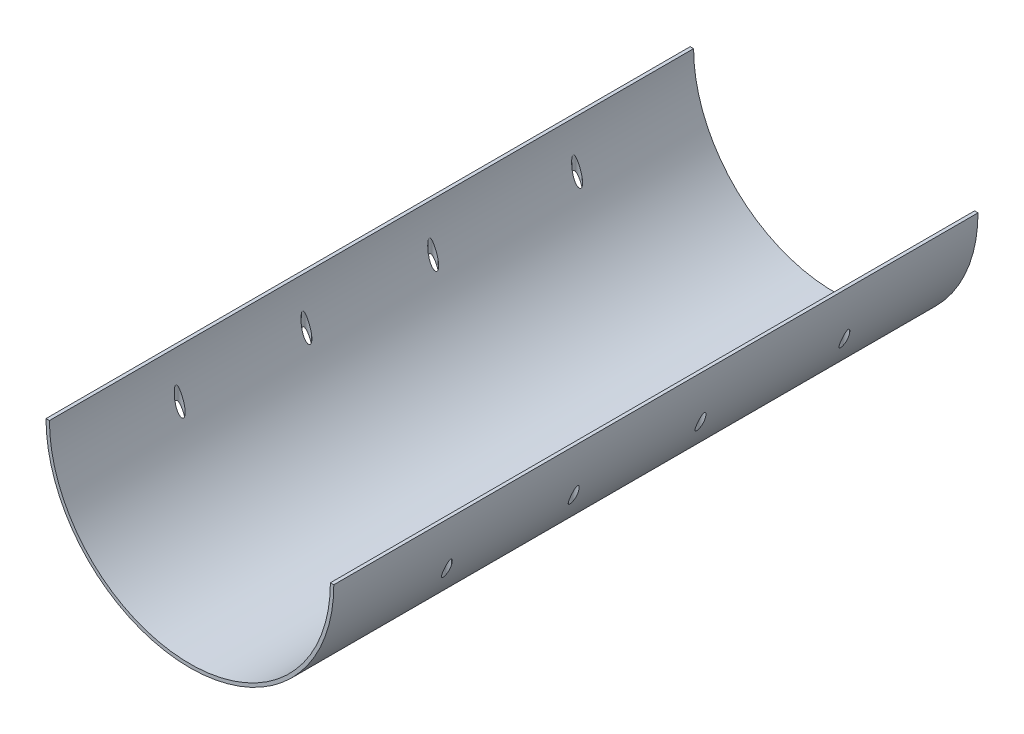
SolidWorks part; units mm, degrees
ref_plane "Plane1" through (0, 0, 0) normal (0, 0, 1) x (1, 0, 0)
ref_plane "Plane2" through (0, 0, 0) normal (0, 1, 0) x (1, 0, 0)
ref_plane "Plane3" through (0, 0, 0) normal (1, 0, 0) x (0, 0, -1)
sketch "Sketch1" plane through (0, 0, 0) normal (0, 0, 1) x (1, 0, 0)
  line L0 (-266.7, 0) -> (-260.35, 0)
  line L1 (260.35, 0) -> (266.7, 0)
  arc A0 (-260.35, 0) -> (260.35, 0) centre (0, 0) ccw
  arc A1 (-266.7, 0) -> (266.7, 0) centre (0, 0) ccw
  dimension "D1" = 520.7
  dimension "D2" = 533.4
extrude "Base-Extrude" add sketch "Sketch1" along normal blind 1193.8
sketch "Sketch2" plane through (0, 0, 0) normal (0, 1, 0) x (1, 0, 0)
  line L0 (0, 0) -> (0, -1016) construction
  line L1 (0, -1193.8) -> (0, 0) construction
  line L2 (-260.35, -1193.8) -> (260.35, -1193.8) construction
  line L3 (0, -1016) -> (0, -1868.9552) construction
  circle A0 centre (0, -279.4) radius 12.7
  circle A1 centre (0, -965.2) radius 12.7
  circle A2 centre (0, -508) radius 12.7
  circle A3 centre (0, -736.6) radius 12.7
  dimension "D1" = 25.4
  dimension "D3" = 228.6
  dimension "D9" = 228.6
  dimension "D4" = 228.6
  dimension "D2" = 279.4
  dimension "D6" = 228.6
extrude "DrainHoles" [suppressed] cut sketch "Sketch2" against normal through all
sketch "Sketch3" plane through (0, 0, 0) normal (0, 1, 0) x (-1, 0, 0)
  line L0 (4.9403, 774.4798) -> (4.9403, 760.045)
  line L1 (1.7653, 756.87) -> (-1.4097, 756.87)
  line L2 (-4.5847, 760.045) -> (-4.5847, 774.4798)
  line L3 (0.1778, 840.105) -> (0.1778, 741.1428) construction
  arc A1 (7.7341, 777.6318) -> (-7.3785, 777.6318) centre (0.1778, 840.105) ccw
  arc A2 (3.9878, 779.8368) -> (-3.6322, 779.8368) centre (0.1778, 840.105) ccw construction
  arc A3 (1.7653, 756.87) -> (4.9403, 760.045) centre (1.7653, 760.045) ccw
  arc A4 (-1.4097, 756.87) -> (-4.5847, 760.045) centre (-1.4097, 760.045) cw
  arc A5 (4.9403, 774.4798) -> (7.7341, 777.6318) centre (8.1153, 774.4798) cw
  arc A6 (-7.3785, 777.6318) -> (-4.5847, 774.4798) centre (-7.7597, 774.4798) cw
  dimension "D1" = 2.54
  dimension "D3" = 3.175
  dimension "D4" = 3.175
  dimension "D2" = 9.525
extrude "Cut-Extrude1" [suppressed] cut sketch "Sketch3" against normal through all
sketch "Sketch4" [suppressed] plane through (0, 0, 555.625) normal (0, 0, 1) x (1, 0, 0)
  line L0 (298.5655, -126.7342) -> (-0.0015, 0) construction
  line L1 (268.1522, -113.8245) -> (288.0013, -67.0628)
  line L2 (288.0013, -67.0628) -> (177.5885, -20.1954)
  line L3 (177.5885, -20.1954) -> (157.7394, -66.957)
  line L4 (268.1522, -113.8245) -> (157.7394, -66.957)
  line L5 (-0.0015, 0) -> (313.6397, 0) construction
  dimension "D1" = 50.8
  dimension "D2" = 23
revolve "Cut-Revolve1" [suppressed] cut sketch "Sketch4" angle 360 about L0
sketch "Sketch5" [suppressed] plane through (0, 0, 104.775) normal (0, 0, 1) x (1, 0, 0)
  line L0 (-0.0015, 0) -> (282.7872, -120.0367) construction
  line L1 (-0.0015, 0) -> (299.9473, 0) construction
  line L2 (257.3014, -109.2186) -> (277.1505, -62.4569)
  line L3 (179.5967, -21.0478) -> (159.7476, -67.8095)
  line L4 (277.1505, -62.4569) -> (179.5967, -21.0478)
  line L5 (257.3014, -109.2186) -> (159.7476, -67.8095)
  dimension "D1" = 23
  dimension "D2" = 50.8
revolve "Cut-Revolve2" [suppressed] cut sketch "Sketch5" angle 360 about L0
sketch "Sketch6" [suppressed] plane through (0, 0, 0) normal (0, 1, 0) x (1, 0, 0)
  circle A2 centre (0, -1015.365) radius 36.576
  circle A3 centre (0, -1015.365) radius 36.576
  dimension "D2" = 73.152
  dimension "D1" = 5.08
extrude "Cut-Extrude2" [suppressed] cut sketch "Sketch6" against normal through all
sketch "Sketch7" plane through (0, 0, 0) normal (0, 1, 0) x (1, 0, 0)
  circle A0 centre (-247.65, -228.6) radius 7.1755
  circle A4 centre (-247.65, -495.3) radius 7.1755
  circle A5 centre (-247.65, -730.25) radius 7.1755
  circle A6 centre (-247.4757, -965.2) radius 7.1755
  dimension "D1" = 14.351
extrude "Cut-Extrude3" cut sketch "Sketch7" against normal through all
mirror "Mirror1" about plane through (0, 0, 0) normal (1, 0, 0) of "Cut-Extrude3"
